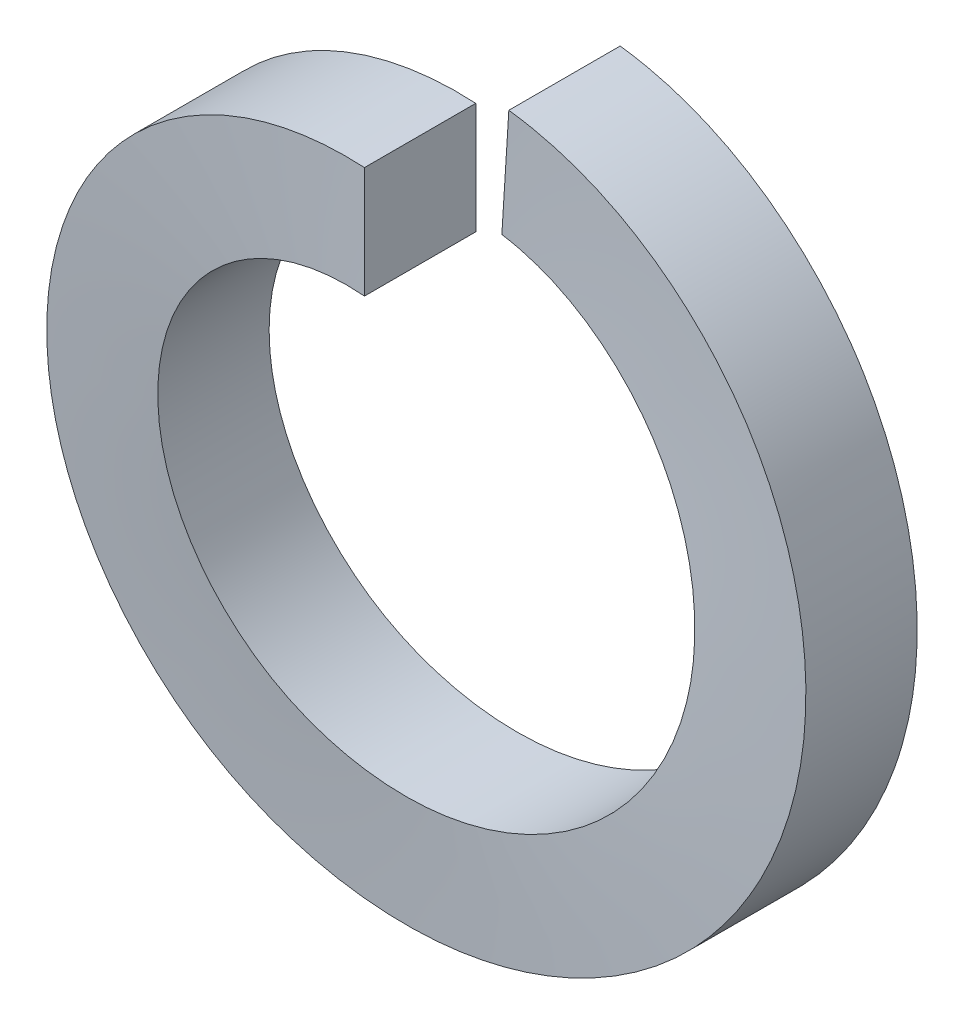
SolidWorks part; units mm, degrees
ref_plane "Front Plane" through (0, 0, 0) normal (0, 0, 1) x (1, 0, 0)
ref_plane "Top Plane" through (0, 0, 0) normal (0, 1, 0) x (1, 0, 0)
ref_plane "Right Plane" through (0, 0, 0) normal (1, 0, 0) x (0, 0, -1)
sketch "Sketch1" plane through (0, 0, 0) normal (0, 0, 1) x (1, 0, 0)
  line L0 (0, 3.7338) -> (0, 2.54) construction
  circle A0 centre (0, 0) radius 3.7338
  circle A1 centre (0, 0) radius 2.54 construction
  dimension "ID" = 5.08
  dimension "OD" = 7.4676
curve "Helix/Spiral1" parameters "HT"=1.3132
sketch "Sketch2" plane through (0, 0, 0) normal (1, 0, 0) x (0, 0, -1)
  line L1 (0, 3.7338) -> (-1.1938, 3.7338)
  line L2 (0, 3.7338) -> (0, 2.54)
  line L3 (0, 2.54) -> (-1.1938, 2.54)
  line L4 (-1.1938, 3.7338) -> (-1.1938, 2.54)
sweep "Sweep1" add profiles "Sketch2" path "Helix/Spiral1"
equation "\"HT@Helix/Spiral1\" = \"THK@Sketch2\"*1.1"
